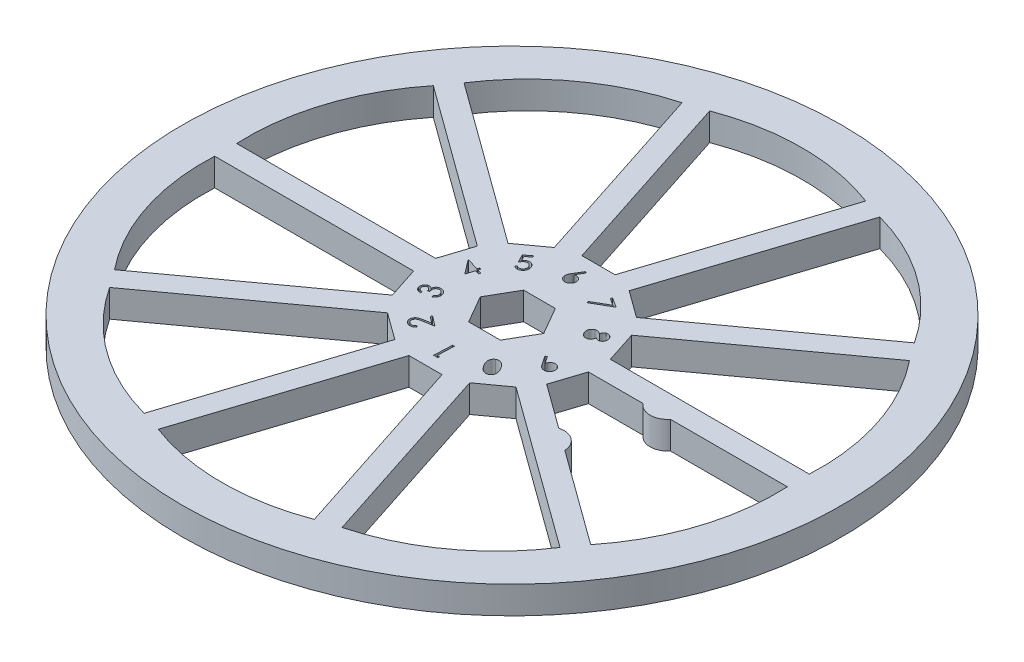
SolidWorks part; units mm, degrees
ref_plane "Front" through (0, 0, 0) normal (0, 0, 1) x (1, 0, 0)
ref_plane "Top" through (0, 0, 0) normal (0, 1, 0) x (1, 0, 0)
ref_plane "Right" through (0, 0, 0) normal (1, 0, 0) x (0, 0, -1)
sketch "Sketch1" plane through (0, 0, 0) normal (0, 1, 0) x (1, 0, 0)
  line L0 (-11.7735, 36.2353) -> (11.7735, -36.2353) construction
  line L1 (30.8235, 22.3946) -> (11.7735, 36.2353) construction
  line L2 (11.7735, 36.2353) -> (-11.7735, 36.2353) construction
  line L3 (-11.7735, 36.2353) -> (-30.8235, 22.3946) construction
  line L4 (-30.8235, 22.3946) -> (-38.1, 0) construction
  line L5 (-38.1, 0) -> (-30.8235, -22.3946) construction
  line L6 (-30.8235, -22.3946) -> (-11.7735, -36.2353) construction
  line L7 (-11.7735, -36.2353) -> (11.7735, -36.2353) construction
  line L8 (11.7735, -36.2353) -> (30.8235, -22.3946) construction
  line L9 (30.8235, -22.3946) -> (38.1, 0) construction
  line L10 (38.1, 0) -> (30.8235, 22.3946) construction
  line L11 (-30.8235, 22.3946) -> (30.8235, -22.3946) construction
  line L12 (38.1, 0) -> (-38.1, 0) construction
  line L13 (11.7735, 36.2353) -> (-11.7735, -36.2353) construction
  line L14 (30.8235, 22.3946) -> (-30.8235, -22.3946) construction
  line L15 (-9.0212, 31.8743) -> (-1.9138, 10)
  line L16 (9.0212, 31.8743) -> (1.9138, 10)
  line L17 (-1.9138, 10) -> (1.9138, 10)
  line L18 (-4.3295, 9.2151) -> (-7.4262, 6.9652)
  line L19 (-26.0336, 20.4843) -> (-7.4262, 6.9652)
  line L20 (-11.4369, 31.0894) -> (-4.3295, 9.2151)
  line L21 (7.4262, 6.9652) -> (4.3295, 9.2151)
  line L22 (11.4369, 31.0894) -> (4.3295, 9.2151)
  line L23 (26.0336, 20.4843) -> (7.4262, 6.9652)
  line L24 (-10.102, -1.27) -> (-8.9192, -4.9103)
  line L25 (-27.5265, -18.4294) -> (-8.9192, -4.9103)
  line L26 (-33.102, -1.27) -> (-10.102, -1.27)
  line L27 (8.9192, -4.9103) -> (10.102, -1.27)
  line L28 (33.102, -1.27) -> (10.102, -1.27)
  line L29 (27.5265, -18.4294) -> (8.9192, -4.9103)
  line L30 (-1.9138, -10) -> (1.9138, -10)
  line L31 (9.0212, -31.8743) -> (1.9138, -10)
  line L32 (-9.0212, -31.8743) -> (-1.9138, -10)
  line L33 (-27.5265, 18.4294) -> (-8.9192, 4.9103)
  line L34 (-33.102, 1.27) -> (-10.102, 1.27)
  line L35 (-10.102, 1.27) -> (-8.9192, 4.9103)
  line L36 (-4.3295, -9.2151) -> (-7.4262, -6.9652)
  line L37 (-26.0336, -20.4843) -> (-7.4262, -6.9652)
  line L38 (-11.4369, -31.0894) -> (-4.3295, -9.2151)
  line L39 (8.9192, 4.9103) -> (10.102, 1.27)
  line L40 (27.5265, 18.4294) -> (8.9192, 4.9103)
  line L41 (33.102, 1.27) -> (10.102, 1.27)
  line L42 (7.4262, -6.9652) -> (4.3295, -9.2151)
  line L43 (26.0336, -20.4843) -> (7.4262, -6.9652)
  line L44 (11.4369, -31.0894) -> (4.3295, -9.2151)
  line L46 (3.6662, 0) -> (1.8331, 3.175)
  line L47 (1.8331, 3.175) -> (-1.8331, 3.175)
  line L48 (-1.8331, 3.175) -> (-3.6662, 0)
  line L49 (-3.6662, 0) -> (-1.8331, -3.175)
  line L50 (-1.8331, -3.175) -> (1.8331, -3.175)
  line L51 (1.8331, -3.175) -> (3.6662, 0)
  circle A0 centre (0, 0) radius 38.1
  arc A1 (-9.0212, 31.8743) -> (9.0212, 31.8743) centre (0, 8.1303) cw
  arc A2 (-11.4369, 31.0894) -> (-26.0336, 20.4843) centre (-4.7789, 6.5776) ccw
  arc A3 (26.0336, 20.4843) -> (11.4369, 31.0894) centre (4.7789, 6.5776) ccw
  arc A4 (-33.102, -1.27) -> (-27.5265, -18.4294) centre (-7.7324, -2.5124) ccw
  arc A5 (27.5265, -18.4294) -> (33.102, -1.27) centre (7.7324, -2.5124) ccw
  arc A6 (-9.0212, -31.8743) -> (9.0212, -31.8743) centre (0, -8.1303) ccw
  arc A7 (-33.102, 1.27) -> (-27.5265, 18.4294) centre (-7.7324, 2.5124) cw
  arc A8 (-11.4369, -31.0894) -> (-26.0336, -20.4843) centre (-4.7789, -6.5776) cw
  arc A9 (27.5265, 18.4294) -> (33.102, 1.27) centre (7.7324, 2.5124) cw
  arc A10 (26.0336, -20.4843) -> (11.4369, -31.0894) centre (4.7789, -6.5776) cw
  circle A11 centre (18, 0) radius 0.35 construction
  circle A12 centre (14.5623, -10.5801) radius 0.35 construction
  circle A13 centre (0, 0) radius 3.175 construction
  dimension "D2" = 23
  dimension "D1" = 76.2
  dimension "D6" = 25.4
  dimension "D7" = 0.7
  dimension "D3" = 2.54
  dimension "D4" = 2.54
  dimension "D5" = 10
  dimension "D8" = 18
  dimension "D9" = 18
  dimension "D10" = 6.35
extrude "Boss-Extrude1" add sketch "Sketch1" along normal blind 3.175
sketch "Sketch4" plane through (0, 3.175, 0) normal (0, 1, 0) x (1, 0, 0)
  circle A0 centre (0, 0) radius 6.5 construction
  text T0 "8     7     6     5     4     3     2     1     0     9" font "Century Gothic" height in points 8
  dimension "D1" = 13
extrude "Cut-Extrude1" cut sketch "Sketch4" against normal through all
sketch "Sketch6" plane through (0, 0, 0) normal (0, 1, 0) x (1, 0, 0)
  line L0 (16.4138, -1.27) -> (19.5862, -1.27)
  line L1 (14.0255, -8.6203) -> (16.5921, -10.485)
  line L2 (27.5265, -18.4294) -> (8.9192, -4.9103) construction
  line L3 (33.102, -1.27) -> (10.102, -1.27) construction
  arc A0 (19.5862, -1.27) -> (16.4138, -1.27) centre (18, 0) cw
  arc A1 (14.0255, -8.6203) -> (16.5921, -10.485) centre (14.5623, -10.5801) cw
  dimension "D1" = 2.032
extrude "Boss-Extrude3" add sketch "Sketch6" along normal blind 3.175
